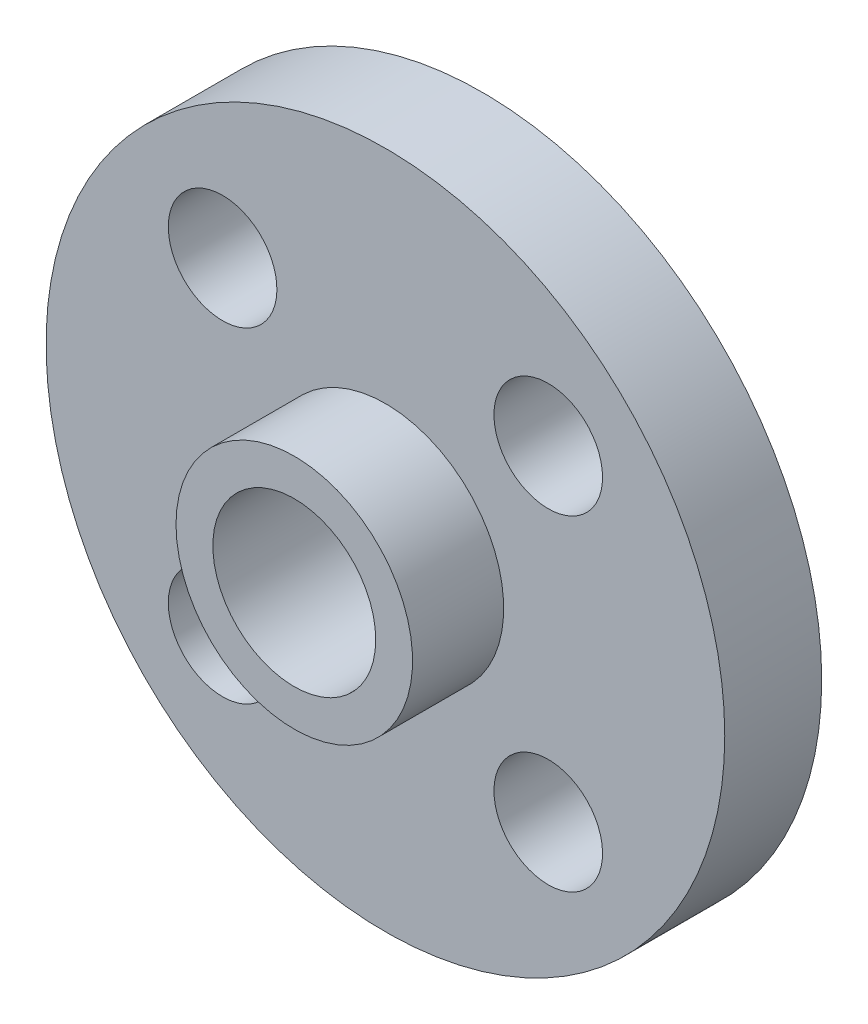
SolidWorks part; units mm, degrees
ref_plane "Front Plane" through (0, 0, 0) normal (0, 0, 1) x (1, 0, 0)
ref_plane "Top Plane" through (0, 0, 0) normal (0, 1, 0) x (1, 0, 0)
ref_plane "Right Plane" through (0, 0, 0) normal (1, 0, 0) x (0, 0, -1)
sketch "Sketch1" plane through (0, 0, 0) normal (0, 0, 1) x (1, 0, 0)
  circle A0 centre (0, 0) radius 44.45
  dimension "BaseOD" = 88.9
extrude "Extrude1" add sketch "Sketch1" along normal blind 12.7
sketch "Sketch3" plane through (0, 0, 0) normal (0, 0, -1) x (-1, 0, 0)
  circle A0 centre (0, 0) radius 15.494
  dimension "ConnOD" = 30.988
extrude "Extrude2" add sketch "Sketch3" against normal blind 24.638
sketch "Sketch4" plane through (0, 0, 12.7) normal (0, 0, 1) x (1, 0, 0)
  line L0 (0, 0) -> (30.1625, 0) construction
  line L1 (0, 0) -> (21.3281, 21.3281) construction
  circle A0 centre (0, 0) radius 30.1625 construction
  circle A1 centre (0, 0) radius 44.45 construction
  circle A2 centre (21.3281, 21.3281) radius 7.112
  dimension "D1" = 45
  dimension "BoltPattDiam" = 60.325
  dimension "HoleDiam" = 14.224
extrude "Cut-Extrude1" cut sketch "Sketch4" against normal through all
pattern_circular "CirPattern1" count 4 over 360 about axis through (0, 0, 0) along (0, 0, 1) of "Cut-Extrude1"
sketch "Sketch5" plane through (0, 0, 0) normal (0, 0, -1) x (-1, 0, 0)
  circle A1 centre (21.3281, -21.3281) radius 7.112 construction
  circle A3 centre (0, 0) radius 18.034
  circle A4 centre (0, 0) radius 18.034
  dimension "D1" = 2.54
extrude "Extrude3" add sketch "Sketch5" along normal blind 0.7937
sketch "Sketch6" plane through (0, 0, 24.638) normal (0, 0, 1) x (1, 0, 0)
  circle A0 centre (0, 0) radius 10.668
  dimension "PipeOD" = 21.336
extrude "Cut-Extrude2" cut sketch "Sketch6" against normal blind 16.6687
sketch "Sketch7" plane through (0, 0, -0.7937) normal (0, 0, -1) x (-1, 0, 0)
  circle A0 centre (0, 0) radius 7.62
  dimension "PipeID" = 15.24
extrude "Cut-Extrude3" cut sketch "Sketch7" against normal up to next
